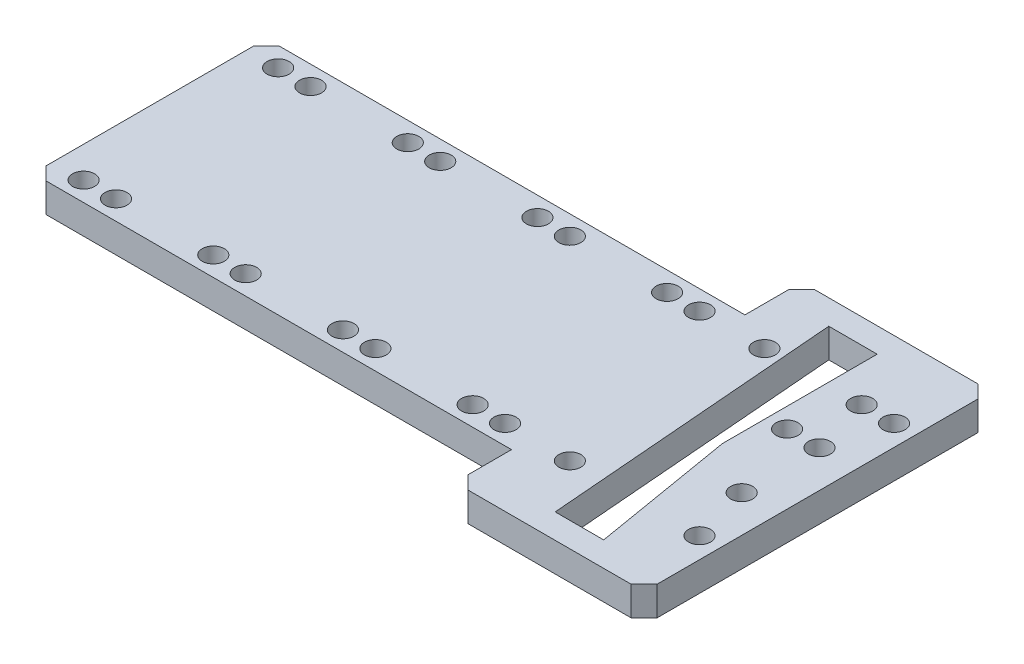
SolidWorks part; units mm, degrees
ref_plane "Front Plane" through (0, 0, 0) normal (0, 0, 1) x (1, 0, 0)
ref_plane "Top Plane" through (0, 0, 0) normal (0, 1, 0) x (1, 0, 0)
ref_plane "Right Plane" through (0, 0, 0) normal (1, 0, 0) x (0, 0, -1)
sketch "Sketch11" plane through (0, 0, 0) normal (0, 1, 0) x (1, 0, 0)
  line L0 (43.25, -0.9121) -> (46.9642, -22.95)
  line L1 (-44, -18) -> (27.8, -18)
  line L2 (-46, 16) -> (-46, -16)
  line L3 (55, 26.75) -> (29.8, 26.75)
  line L4 (27.8, 18) -> (27.8, 24.75)
  line L5 (27.8, 24.75) -> (29.8, 26.75)
  line L6 (27.8, -24.75) -> (29.8, -26.75)
  line L7 (57, 24.75) -> (55, 26.75)
  line L8 (27.8, -18) -> (27.8, -24.75)
  line L9 (55, -26.75) -> (29.8, -26.75)
  line L10 (55, -26.75) -> (57, -24.75)
  line L11 (-44, 18) -> (27.8, 18)
  line L12 (-47, 0) -> (69.3156, 0) construction
  line L14 (-44, 18) -> (-46, 16)
  line L15 (39.4842, -22.95) -> (35.7832, 22.95)
  line L16 (-46, -16) -> (-44, -18)
  line L17 (46.9642, -22.95) -> (39.4842, -22.95)
  line L19 (35.7832, 22.95) -> (43.25, 22.95)
  line L20 (43.25, 22.95) -> (43.25, -0.9121)
  line L30 (57, -24.75) -> (57, 24.75)
  circle A0 centre (53.8, 15) radius 1.7
  circle A1 centre (48.8, 15) radius 1.7
  circle A2 centre (53.8, -15) radius 1.7
  circle A4 centre (-41.2, 15) radius 1.7
  circle A5 centre (-21.2, 15) radius 1.7
  circle A6 centre (-16.2, 15) radius 1.7
  circle A7 centre (33.8, -15) radius 1.7
  circle A8 centre (-36.2, 15) radius 1.7
  circle A9 centre (-1.2, 15) radius 1.7
  circle A10 centre (3.8, 15) radius 1.7
  circle A11 centre (23.8, -15) radius 1.7
  circle A12 centre (18.8, 15) radius 1.7
  circle A13 centre (23.8, 15) radius 1.7
  circle A14 centre (18.8, -15) radius 1.7
  circle A15 centre (3.8, -15) radius 1.7
  circle A16 centre (-1.2, -15) radius 1.7
  circle A17 centre (-36.2, -15) radius 1.7
  circle A18 centre (-16.2, -15) radius 1.7
  circle A19 centre (-21.2, -15) radius 1.7
  circle A20 centre (-41.2, -15) radius 1.7
  circle A64 centre (33.8, 15) radius 1.7
  circle A73 centre (46.3, 6) radius 1.7
  circle A77 centre (51.3, 6) radius 1.7
  circle A78 centre (51.3, -6) radius 1.7
  point P3 (57, 26.75)
  point P10 (57, -26.75)
  dimension "D1" = 2
extrude "Boss-Extrude4" add sketch "Sketch11" along normal blind 4.5
